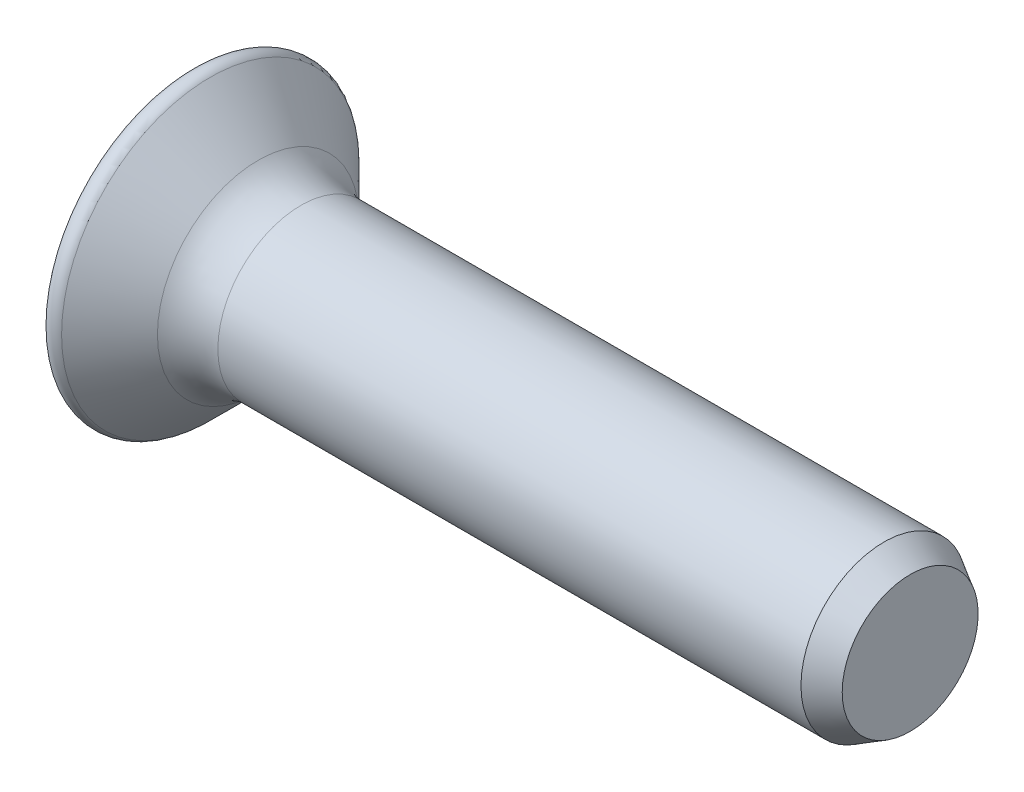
SolidWorks part; units mm, degrees
ref_plane "Front Plane" through (0, 0, 0) normal (0, 0, 1) x (1, 0, 0)
ref_plane "Top Plane" through (0, 0, 0) normal (0, 1, 0) x (1, 0, 0)
ref_plane "Right Plane" through (0, 0, 0) normal (1, 0, 0) x (0, 0, -1)
other "Configuration Table"
sketch "Sketch1" plane through (0, 0, 0) normal (0, 0, 1) x (1, 0, 0)
  line L0 (0, 0) -> (6.2784, 0) construction
  line L3 (-1.6, 0) -> (-1.6, -1.8061) construction
  line L4 (-1.6, 0) -> (8.4, 0)
  line L5 (0, 1.1) -> (8.4, 1.1)
  line L6 (8.4, 1.1) -> (8.4, 0)
  line L7 (0, 1.1) -> (-0.869, 1.969)
  arc A0 (-1.1, 1.9365) -> (-1.6, 0) centre (2.4, 0) ccw
  arc A1 (-1.1, 1.9365) -> (-0.869, 1.969) centre (-0.9723, 1.8658) cw
revolve "Revolve1" add sketch "Sketch1" angle 360 about L0
chamfer "Chamfer1" distance 0.2 angle 60 1 edges at (8.4, 0, 1.1)
sketch "Sketch5" plane through (0, 0, 0) normal (0, 0, 1) x (1, 0, 0)
  line L0 (0.3703, 0.825) -> (0.2069, 0.825)
  line L1 (0.2069, 0.825) -> (0.0481, 1.1)
  line L2 (0.3703, 0.825) -> (0.529, 1.1)
  line L3 (0.0481, 1.1) -> (0.0481, 1.35)
  line L4 (0.529, 1.1) -> (0.529, 1.35)
  line L5 (0.0481, 1.35) -> (0.529, 1.35)
  line L6 (0.2886, 0.825) -> (0.2886, 0) construction
  line L7 (0, 0) -> (7.3035, 0) construction
  line L9 (0, 1.1) -> (0, -1.1) construction
  line L12 (8.0536, 1.1) -> (0, 1.1) construction
revolve "ThreadSchematic" [suppressed] cut sketch "Sketch5" angle 360 about L7
pattern_linear "ThdSchPat" [suppressed] count 18 spacing 0.4809 along (1, 0, 0)
sketch "Sketch2" plane through (0, 0, 0) normal (0, 0, 1) x (1, 0, 0)
  line L0 (0, 0) -> (5.7679, 0) construction
  line L1 (8.4, 0) -> (6.4947, 1.1)
  line L2 (8.4, 1.1) -> (8.4, 0) construction
  line L4 (6.4947, 1.1) -> (6.4947, 1.2)
  line L5 (6.4947, 1.2) -> (8.5, 1.2)
  line L6 (8.5, 1.2) -> (8.5, 0)
  line L7 (8.5, 0) -> (8.4, 0)
  point P5 (0, 1.1)
  dimension "D1" = 30
  dimension "D2" = 0.1
  dimension "D3" = 0.1
revolve "EndCone" [suppressed] cut sketch "Sketch2" angle 360 about L0
ref_plane "Plane4" through (-1.6, 0, 0) normal (1, 0, 0) x (0, 0, -1)
sketch "Sketch3" plane through (-1.6, 0, 0) normal (1, 0, 0) x (0, 0, -1)
  line L0 (0, 2.343) -> (0, -2.4842) construction
  line L1 (2.7661, 0) -> (-3.4558, 0) construction
  line L2 (-0.22, 1.1) -> (0.22, 1.1)
  line L3 (0.22, 1.1) -> (0.1467, 0.7333)
  line L4 (0, 0) -> (1.9578, 1.9578) construction
  line L5 (0.1467, 0.7333) -> (0.3614, 0.3614)
  line L6 (0.1467, 0.7333) -> (0, 0) construction
  line L7 (-0.1467, 0.7333) -> (-0.3614, 0.3614)
  line L8 (-0.22, 1.1) -> (-0.1467, 0.7333)
  line L9 (1.1, 0.22) -> (1.1, -0.22)
  line L10 (1.1, -0.22) -> (0.7333, -0.1467)
  line L11 (0.7333, -0.1467) -> (0.3614, -0.3614)
  line L12 (0.7333, 0.1467) -> (0.3614, 0.3614)
  line L13 (1.1, 0.22) -> (0.7333, 0.1467)
  line L14 (0.22, -1.1) -> (-0.22, -1.1)
  line L15 (-0.22, -1.1) -> (-0.1467, -0.7333)
  line L16 (-0.1467, -0.7333) -> (-0.3614, -0.3614)
  line L17 (0.1467, -0.7333) -> (0.3614, -0.3614)
  line L18 (0.22, -1.1) -> (0.1467, -0.7333)
  line L19 (-1.1, -0.22) -> (-1.1, 0.22)
  line L20 (-1.1, 0.22) -> (-0.7333, 0.1467)
  line L21 (-0.7333, 0.1467) -> (-0.3614, 0.3614)
  line L22 (-0.7333, -0.1467) -> (-0.3614, -0.3614)
  line L23 (-1.1, -0.22) -> (-0.7333, -0.1467)
  point P14 (0, 1.1)
  point P23 (1.1, 0)
  point P30 (0, -1.1)
  point P37 (-1.1, 0)
extrude "Cut-Extrude1" cut sketch "Sketch3" along normal blind 0.8 draft 6
sketch "Sketch4" plane through (-1.6, 0, 0) normal (1, 0, 0) x (0, 0, -1)
  line L0 (0, 2.1951) -> (0, -2.1951) construction
  line L1 (2.1996, 0) -> (-2.3835, 0) construction
  line L2 (-0.9723, -0.9723) -> (0.9723, 0.9723) construction
  line L3 (1.1, 0.275) -> (-1.1, 0.275)
  line L4 (1.1, 0.275) -> (1.1, -0.275)
  line L5 (1.1, -0.275) -> (-1.1, -0.275)
  line L6 (-1.1, 0.275) -> (-1.1, -0.275)
  line L7 (0.275, 1.1) -> (-0.275, 1.1)
  line L8 (0.275, 1.1) -> (0.275, -1.1)
  line L9 (0.275, -1.1) -> (-0.275, -1.1)
  line L10 (-0.275, 1.1) -> (-0.275, -1.1)
  line L11 (0.9723, 0.9723) -> (0.4468, 0.275)
  line L12 (0.9723, 0.9723) -> (0.275, 0.4468)
  line L13 (0.275, 0.4468) -> (-0.275, 0.4468) construction
  line L14 (0, 0) -> (-0.9723, 0.9723) construction
  line L15 (-0.9723, -0.9723) -> (-0.275, -0.4468)
  line L16 (-0.9723, -0.9723) -> (-0.4468, -0.275)
  line L17 (-0.275, 0.4468) -> (-0.9723, 0.9723)
  line L18 (-0.9723, 0.9723) -> (-0.4468, 0.275)
  line L19 (-0.4468, -0.275) -> (-0.4468, 0.275) construction
  line L20 (0.4468, -0.275) -> (0.9723, -0.9723)
  line L21 (0.9723, -0.9723) -> (0.275, -0.4468)
  circle A0 centre (0, 0) radius 1.375 construction
extrude "TypeZ" [suppressed] cut sketch "Sketch4" along normal blind 0.8
fillet "Fillet1" radius 0.8 1 edges at (0, 0, 1.1)
equation "\"D1@ThreadCosmetic\" = \"l@Sketch1\" - \"D1@Chamfer1\""
equation "\"minordia@Sketch5\" = \"D2@ThreadCosmetic\""
equation "\"D1@Plane4\" = \"k@Sketch1\" + \"f@Sketch1\""
equation "\"D5@Sketch3\" = \"m@Sketch3\" * 2 / 3"
equation "\"D3@Sketch3\" = \"m@Sketch3\" / 5"
equation "\"D1@Cut-Extrude1\" =  ( \"k@Sketch1\" + \"f@Sketch1\" )  / 2"
equation "\"m@Sketch4\" = \"m@Sketch3\""
equation "\"D2@Sketch4\" =  \"m@Sketch4\" / 4"
equation "\"D1@TypeZ\" =  ( \"k@Sketch1\" + \"f@Sketch1\" )  / 2"
equation "\"D1@Sketch4\" = \"m@Sketch4\" * 5 / 4"
equation "\"threadstart@Sketch5\" = \"advance@Sketch5\"*0.6"
equation "\"D1@ThdSchPat\" = int(((\"l@Sketch1\"-\"k@Sketch1\")/\"advance@Sketch5\") + 0.8)"
equation "\"D3@ThdSchPat\" = \"advance@Sketch5\""
